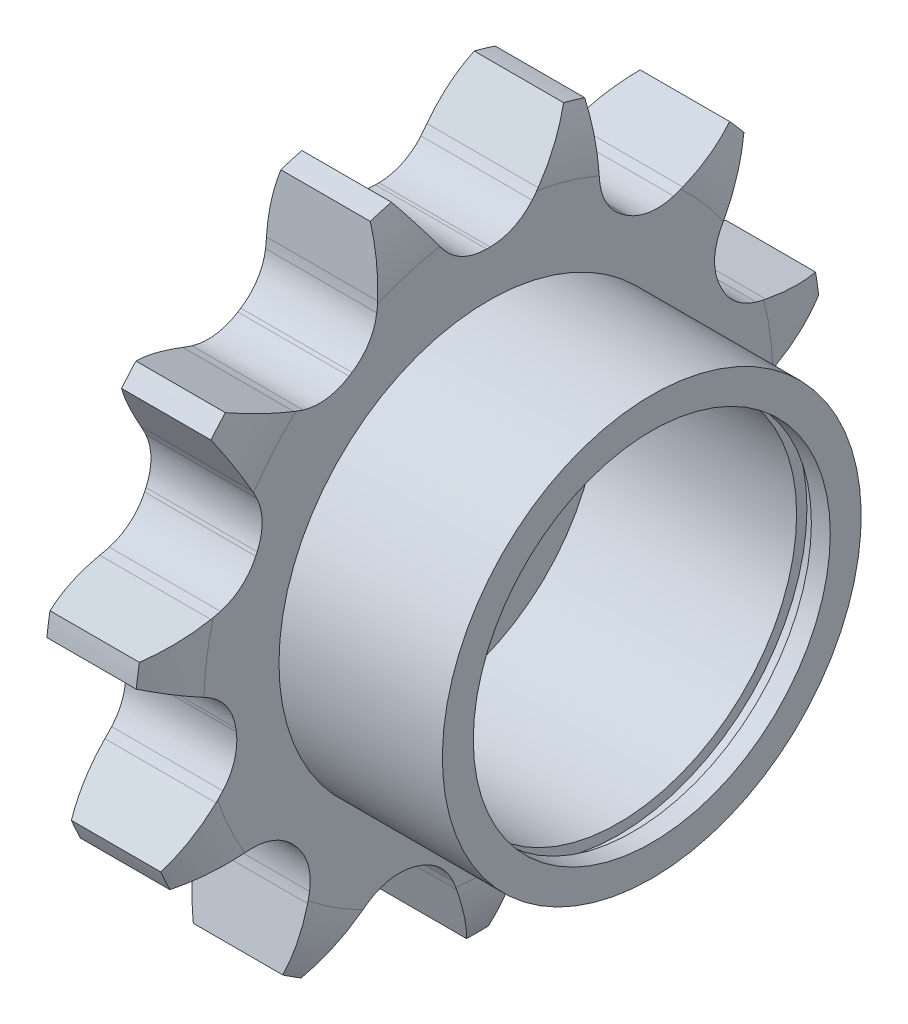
SolidWorks part; units mm, degrees
ref_plane "Front" through (0, 0, 0) normal (0, 0, 1) x (1, 0, 0)
ref_plane "Top" through (0, 0, 0) normal (0, 1, 0) x (1, 0, 0)
ref_plane "Right" through (0, 0, 0) normal (1, 0, 0) x (0, 0, -1)
imported_body "2116-11"
sketch "Esquisse1" plane through (0, 0, 0) normal (0, 1, 0) x (1, 0, 0)
  line L0 (40, 0) -> (40, 26)
  line L1 (16.2, 0) -> (40, 0) construction
  line L2 (40, -30.5) -> (40, 30.5) construction
  line L3 (40, 26) -> (37.25, 26)
  line L4 (37.25, 26) -> (37.25, 27.5)
  line L5 (37.25, 27.5) -> (35.1, 27.5)
  line L6 (35.1, 27.5) -> (35.1, 26)
  line L7 (35.1, 26) -> (6.2, 26)
  line L9 (6.2, 26) -> (6.2, 0)
  line L14 (6.2, 0) -> (40, 0)
  dimension "D1" = 26
  dimension "D2" = 27.5
  dimension "D3" = 33.8
  dimension "D4" = 2.75
  dimension "D5" = 2.15
revolve "Enlèvement de matière-Révolution1" cut sketch "Esquisse1" angle 360
sketch "Esquisse2" plane through (0, 0, 0) normal (-1, 0, 0) x (0, 0, 1)
  circle A0 centre (0, 0) radius 17.5
  dimension "D1" = 35
extrude "Enlèv. mat.-Extru.1" cut sketch "Esquisse2" against normal through all
